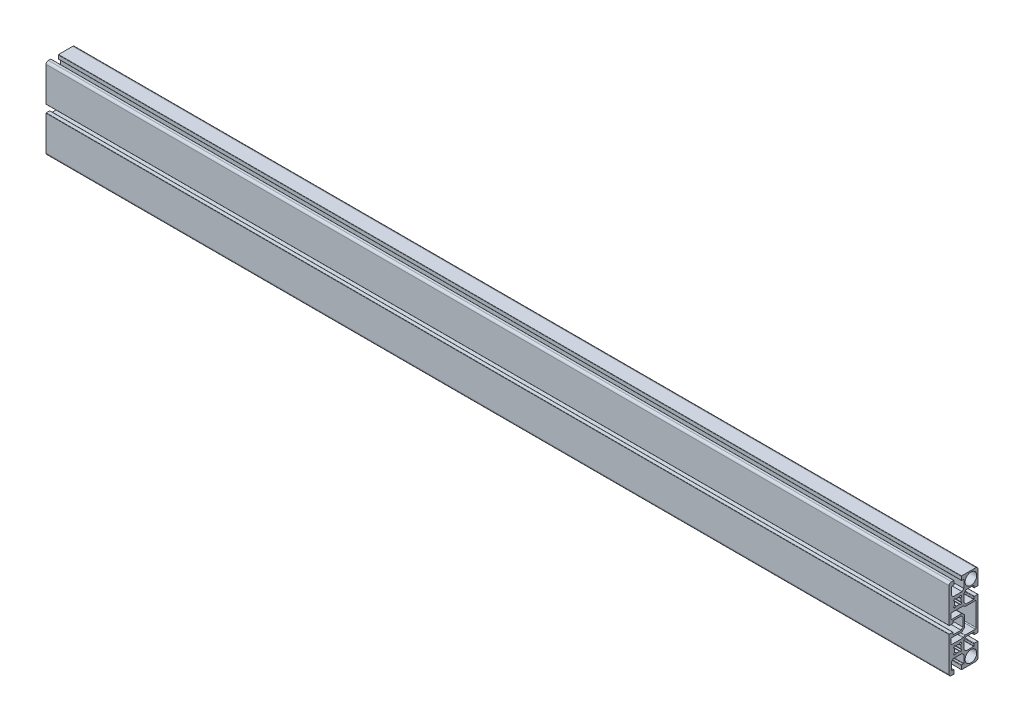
SolidWorks part; units mm, degrees
ref_plane "Front Plane" through (0, 0, 0) normal (0, 0, 1) x (1, 0, 0)
ref_plane "Top Plane" through (0, 0, 0) normal (0, 1, 0) x (1, 0, 0)
ref_plane "Right Plane" through (0, 0, 0) normal (1, 0, 0) x (0, 0, -1)
sketch "Sketch1" plane through (0, 0, 0) normal (0, 0, 1) x (1, 0, 0)
  line L0 (0, 0) -> (1000, 0)
  dimension "D1" = 1000
other "45-sarja 1.0033 90X32(1)"
ref_plane "Plane1" through (0, 0, 0) normal (1, 0, 0) x (0, 1, 0)
sketch "Model23" plane through (0, 0, 0) normal (1, 0, 0) x (0, 1, 0)
  line L0 (-12.7, -20.5) -> (12.7, -20.5)
  line L1 (13.7, -19.5) -> (13.7, -8.5072)
  line L2 (13.9929, -7.8) -> (15.0071, -6.7858)
  line L3 (15.3, -6.0787) -> (15.3, 6.5)
  line L4 (14.3, 7.5) -> (9.8, 7.5)
  line L5 (8.8, 6.5) -> (8.8, -4.4929)
  line L6 (8.5071, -5.2) -> (6.2, -7.5071)
  line L7 (5.4929, -7.8) -> (-5.4929, -7.8)
  line L8 (-6.2, -7.5071) -> (-8.5071, -5.2)
  line L9 (-8.8, -4.4929) -> (-8.8, 6.5)
  line L10 (-9.8, 7.5) -> (-14.3, 7.5)
  line L11 (-15.3, 6.5) -> (-15.3, -6.0787)
  line L12 (-15.0071, -6.7858) -> (-13.9929, -7.8)
  line L13 (-13.7, -8.5071) -> (-13.7, -19.5)
  line L14 (-25.8941, 4.3841) -> (-26.8841, 3.3941)
  line L15 (-26.8841, 2.9698) -> (-25.8633, 1.9491)
  line L16 (-25.8633, -1.9491) -> (-26.8841, -2.9698)
  line L17 (-26.8841, -3.3941) -> (-25.8941, -4.3841)
  line L18 (-25.4698, -4.3841) -> (-24.4491, -3.3633)
  line L19 (-20.5509, -3.3633) -> (-19.5302, -4.3841)
  line L20 (-19.1059, -4.3841) -> (-18.1159, -3.3941)
  line L21 (-18.1159, -2.9698) -> (-19.1367, -1.9491)
  line L22 (-19.1367, 1.9491) -> (-18.1159, 2.9698)
  line L23 (-18.1159, 3.3941) -> (-19.1059, 4.3841)
  line L24 (-19.5302, 4.3841) -> (-20.5509, 3.3633)
  line L25 (-24.4491, 3.3633) -> (-25.4698, 4.3841)
  line L26 (-41, -4.1) -> (-44.7, -4.1)
  line L27 (-40.5, -6.5) -> (-40.5, -4.6)
  line L28 (-31.7, -6.8) -> (-40.2, -6.8)
  line L29 (-29.7, -4.8) -> (-31.7, -6.8)
  line L30 (-29.7, 4.8) -> (-29.7, -4.8)
  line L31 (-31.7, 6.8) -> (-29.7, 4.8)
  line L32 (-40.2, 6.8) -> (-31.7, 6.8)
  line L33 (-40.5, 4.6) -> (-40.5, 6.5)
  line L34 (-44.7, 4.1) -> (-41, 4.1)
  line L35 (-45, 7) -> (-45, 4.4)
  line L36 (-4.4, 9.5) -> (-42.5, 9.5)
  line L37 (-4.1, 5.5) -> (-4.1, 9.2)
  line L38 (-6.5, 5) -> (-4.6, 5)
  line L39 (-6.8, -3.8) -> (-6.8, 4.7)
  line L40 (-4.8, -5.8) -> (-6.8, -3.8)
  line L41 (4.8, -5.8) -> (-4.8, -5.8)
  line L42 (6.8, -3.8) -> (4.8, -5.8)
  line L43 (6.8, 4.7) -> (6.8, -3.8)
  line L44 (4.6, 5) -> (6.5, 5)
  line L45 (4.1, 9.2) -> (4.1, 5.5)
  line L46 (42.5, 9.5) -> (4.4, 9.5)
  line L47 (45, 4.4) -> (45, 7)
  line L48 (41, 4.1) -> (44.7, 4.1)
  line L49 (40.5, 6.5) -> (40.5, 4.6)
  line L50 (31.7, 6.8) -> (40.2, 6.8)
  line L51 (29.7, 4.8) -> (31.7, 6.8)
  line L52 (29.7, -4.8) -> (29.7, 4.8)
  line L53 (31.7, -6.8) -> (29.7, -4.8)
  line L54 (40.2, -6.8) -> (31.7, -6.8)
  line L55 (40.5, -4.6) -> (40.5, -6.5)
  line L56 (44.7, -4.1) -> (41, -4.1)
  line L57 (45, -20) -> (45, -4.4)
  line L58 (26.9, -22.5) -> (42.5, -22.5)
  line L59 (26.6, -18.5) -> (26.6, -22.2)
  line L60 (29, -18) -> (27.1, -18)
  line L61 (29.3, -9.2) -> (29.3, -17.7)
  line L62 (27.3, -7.2) -> (29.3, -9.2)
  line L63 (17.7, -7.2) -> (27.3, -7.2)
  line L64 (15.7, -9.2) -> (17.7, -7.2)
  line L65 (15.7, -17.7) -> (15.7, -9.2)
  line L66 (17.9, -18) -> (16, -18)
  line L67 (18.4, -22.2) -> (18.4, -18.5)
  line L68 (-18.1, -22.5) -> (18.1, -22.5)
  line L69 (-18.4, -18.5) -> (-18.4, -22.2)
  line L70 (-16, -18) -> (-17.9, -18)
  line L71 (-15.7, -9.2) -> (-15.7, -17.7)
  line L72 (-17.7, -7.2) -> (-15.7, -9.2)
  line L73 (-27.3, -7.2) -> (-17.7, -7.2)
  line L74 (-29.3, -9.2) -> (-27.3, -7.2)
  line L75 (-29.3, -17.7) -> (-29.3, -9.2)
  line L76 (-27.1, -18) -> (-29, -18)
  line L77 (-26.6, -22.2) -> (-26.6, -18.5)
  line L78 (-42.5, -22.5) -> (-26.9, -22.5)
  line L79 (-45, -4.4) -> (-45, -20)
  line L80 (19.1059, 4.3841) -> (18.1159, 3.3941)
  line L81 (18.1159, 2.9698) -> (19.1367, 1.9491)
  line L82 (19.1367, -1.9491) -> (18.1159, -2.9698)
  line L83 (18.1159, -3.3941) -> (19.1059, -4.3841)
  line L84 (19.5302, -4.3841) -> (20.5509, -3.3633)
  line L85 (24.4491, -3.3633) -> (25.4698, -4.3841)
  line L86 (25.8941, -4.3841) -> (26.8841, -3.3941)
  line L87 (26.8841, -2.9698) -> (25.8633, -1.9491)
  line L88 (25.8633, 1.9491) -> (26.8841, 2.9698)
  line L89 (26.8841, 3.3941) -> (25.8941, 4.3841)
  line L90 (25.4698, 4.3841) -> (24.4491, 3.3633)
  line L91 (20.5509, 3.3633) -> (19.5302, 4.3841)
  arc A0 (-13.7, -19.5) -> (-12.7, -20.5) centre (-12.7, -19.5) ccw
  arc A1 (12.7, -20.5) -> (13.7, -19.5) centre (12.7, -19.5) ccw
  arc A2 (13.9929, -7.8) -> (13.7, -8.5072) centre (14.7, -8.5072) ccw
  arc A3 (15.0071, -6.7858) -> (15.3, -6.0787) centre (14.3, -6.0787) ccw
  arc A4 (15.3, 6.5) -> (14.3, 7.5) centre (14.3, 6.5) ccw
  arc A5 (9.8, 7.5) -> (8.8, 6.5) centre (9.8, 6.5) ccw
  arc A6 (8.5071, -5.2) -> (8.8, -4.4929) centre (7.8, -4.4929) ccw
  arc A7 (5.4929, -7.8) -> (6.2, -7.5071) centre (5.4929, -6.8) ccw
  arc A8 (-6.2, -7.5071) -> (-5.4929, -7.8) centre (-5.4929, -6.8) ccw
  arc A9 (-8.8, -4.4929) -> (-8.5071, -5.2) centre (-7.8, -4.4929) ccw
  arc A10 (-8.8, 6.5) -> (-9.8, 7.5) centre (-9.8, 6.5) ccw
  arc A11 (-14.3, 7.5) -> (-15.3, 6.5) centre (-14.3, 6.5) ccw
  arc A12 (-15.3, -6.0787) -> (-15.0071, -6.7858) centre (-14.3, -6.0787) ccw
  arc A13 (-13.7, -8.5071) -> (-13.9929, -7.8) centre (-14.7, -8.5071) ccw
  arc A14 (-25.4698, 4.3841) -> (-25.8941, 4.3841) centre (-25.682, 4.1719) ccw
  arc A15 (-26.8841, 3.3941) -> (-26.8841, 2.9698) centre (-26.6719, 3.182) ccw
  arc A16 (-25.8056, 1.6059) -> (-25.8633, 1.9491) centre (-26.0754, 1.7369) ccw
  arc A17 (-25.8056, 1.6059) -> (-25.8056, -1.6059) centre (-22.5, 0) ccw
  arc A18 (-25.8633, -1.9491) -> (-25.8056, -1.6059) centre (-26.0754, -1.7369) ccw
  arc A19 (-26.8841, -2.9698) -> (-26.8841, -3.3941) centre (-26.6719, -3.182) ccw
  arc A20 (-25.8941, -4.3841) -> (-25.4698, -4.3841) centre (-25.682, -4.1719) ccw
  arc A21 (-24.1059, -3.3056) -> (-24.4491, -3.3633) centre (-24.2369, -3.5754) ccw
  arc A22 (-24.1059, -3.3056) -> (-20.8941, -3.3056) centre (-22.5, 0) ccw
  arc A23 (-20.5509, -3.3633) -> (-20.8941, -3.3056) centre (-20.7631, -3.5754) ccw
  arc A24 (-19.5302, -4.3841) -> (-19.1059, -4.3841) centre (-19.318, -4.1719) ccw
  arc A25 (-18.1159, -3.3941) -> (-18.1159, -2.9698) centre (-18.3281, -3.182) ccw
  arc A26 (-19.1944, -1.6059) -> (-19.1367, -1.9491) centre (-18.9246, -1.7369) ccw
  arc A27 (-19.1944, -1.6059) -> (-19.1944, 1.6059) centre (-22.5, 0) ccw
  arc A28 (-19.1367, 1.9491) -> (-19.1944, 1.6059) centre (-18.9246, 1.7369) ccw
  arc A29 (-18.1159, 2.9698) -> (-18.1159, 3.3941) centre (-18.3281, 3.182) ccw
  arc A30 (-19.1059, 4.3841) -> (-19.5302, 4.3841) centre (-19.318, 4.1719) ccw
  arc A31 (-20.8941, 3.3056) -> (-20.5509, 3.3633) centre (-20.7631, 3.5754) ccw
  arc A32 (-20.8941, 3.3056) -> (-24.1059, 3.3056) centre (-22.5, 0) ccw
  arc A33 (-24.4491, 3.3633) -> (-24.1059, 3.3056) centre (-24.2369, 3.5754) ccw
  circle A34 centre (-37.15, -14.65) radius 6.45
  arc A35 (-40.5, -4.6) -> (-41, -4.1) centre (-41, -4.6) ccw
  arc A36 (-40.5, -6.5) -> (-40.2, -6.8) centre (-40.2, -6.5) ccw
  arc A37 (-40.2, 6.8) -> (-40.5, 6.5) centre (-40.2, 6.5) ccw
  arc A38 (-41, 4.1) -> (-40.5, 4.6) centre (-41, 4.6) ccw
  arc A39 (-45, 4.4) -> (-44.7, 4.1) centre (-44.7, 4.4) ccw
  arc A40 (-42.5, 9.5) -> (-45, 7) centre (-42.5, 7) ccw
  arc A41 (-4.1, 9.2) -> (-4.4, 9.5) centre (-4.4, 9.2) ccw
  arc A42 (-4.6, 5) -> (-4.1, 5.5) centre (-4.6, 5.5) ccw
  arc A43 (-6.5, 5) -> (-6.8, 4.7) centre (-6.5, 4.7) ccw
  arc A44 (6.8, 4.7) -> (6.5, 5) centre (6.5, 4.7) ccw
  arc A45 (4.1, 5.5) -> (4.6, 5) centre (4.6, 5.5) ccw
  arc A46 (4.4, 9.5) -> (4.1, 9.2) centre (4.4, 9.2) ccw
  arc A47 (45, 7) -> (42.5, 9.5) centre (42.5, 7) ccw
  arc A48 (44.7, 4.1) -> (45, 4.4) centre (44.7, 4.4) ccw
  arc A49 (40.5, 4.6) -> (41, 4.1) centre (41, 4.6) ccw
  arc A50 (40.5, 6.5) -> (40.2, 6.8) centre (40.2, 6.5) ccw
  arc A51 (40.2, -6.8) -> (40.5, -6.5) centre (40.2, -6.5) ccw
  arc A52 (41, -4.1) -> (40.5, -4.6) centre (41, -4.6) ccw
  arc A53 (45, -4.4) -> (44.7, -4.1) centre (44.7, -4.4) ccw
  arc A54 (42.5, -22.5) -> (45, -20) centre (42.5, -20) ccw
  arc A55 (26.6, -22.2) -> (26.9, -22.5) centre (26.9, -22.2) ccw
  arc A56 (27.1, -18) -> (26.6, -18.5) centre (27.1, -18.5) ccw
  arc A57 (29, -18) -> (29.3, -17.7) centre (29, -17.7) ccw
  arc A58 (15.7, -17.7) -> (16, -18) centre (16, -17.7) ccw
  arc A59 (18.4, -18.5) -> (17.9, -18) centre (17.9, -18.5) ccw
  arc A60 (18.1, -22.5) -> (18.4, -22.2) centre (18.1, -22.2) ccw
  arc A61 (-18.4, -22.2) -> (-18.1, -22.5) centre (-18.1, -22.2) ccw
  arc A62 (-17.9, -18) -> (-18.4, -18.5) centre (-17.9, -18.5) ccw
  arc A63 (-16, -18) -> (-15.7, -17.7) centre (-16, -17.7) ccw
  arc A64 (-29.3, -17.7) -> (-29, -18) centre (-29, -17.7) ccw
  arc A65 (-26.6, -18.5) -> (-27.1, -18) centre (-27.1, -18.5) ccw
  arc A66 (-26.9, -22.5) -> (-26.6, -22.2) centre (-26.9, -22.2) ccw
  arc A67 (-45, -20) -> (-42.5, -22.5) centre (-42.5, -20) ccw
  arc A68 (-44.7, -4.1) -> (-45, -4.4) centre (-44.7, -4.4) ccw
  circle A69 centre (37.15, -14.65) radius 6.45
  arc A70 (19.5302, 4.3841) -> (19.1059, 4.3841) centre (19.318, 4.1719) ccw
  arc A71 (18.1159, 3.3941) -> (18.1159, 2.9698) centre (18.3281, 3.182) ccw
  arc A72 (19.1944, 1.6059) -> (19.1367, 1.9491) centre (18.9246, 1.7369) ccw
  arc A73 (19.1944, 1.6059) -> (19.1944, -1.6059) centre (22.5, 0) ccw
  arc A74 (19.1367, -1.9491) -> (19.1944, -1.6059) centre (18.9246, -1.7369) ccw
  arc A75 (18.1159, -2.9698) -> (18.1159, -3.3941) centre (18.3281, -3.182) ccw
  arc A76 (19.1059, -4.3841) -> (19.5302, -4.3841) centre (19.318, -4.1719) ccw
  arc A77 (20.8941, -3.3056) -> (20.5509, -3.3633) centre (20.7631, -3.5754) ccw
  arc A78 (20.8941, -3.3056) -> (24.1059, -3.3056) centre (22.5, 0) ccw
  arc A79 (24.4491, -3.3633) -> (24.1059, -3.3056) centre (24.2369, -3.5754) ccw
  arc A80 (25.4698, -4.3841) -> (25.8941, -4.3841) centre (25.682, -4.1719) ccw
  arc A81 (26.8841, -3.3941) -> (26.8841, -2.9698) centre (26.6719, -3.182) ccw
  arc A82 (25.8056, -1.6059) -> (25.8633, -1.9491) centre (26.0754, -1.7369) ccw
  arc A83 (25.8056, -1.6059) -> (25.8056, 1.6059) centre (22.5, 0) ccw
  arc A84 (25.8633, 1.9491) -> (25.8056, 1.6059) centre (26.0754, 1.7369) ccw
  arc A85 (26.8841, 2.9698) -> (26.8841, 3.3941) centre (26.6719, 3.182) ccw
  arc A86 (25.8941, 4.3841) -> (25.4698, 4.3841) centre (25.682, 4.1719) ccw
  arc A87 (24.1059, 3.3056) -> (24.4491, 3.3633) centre (24.2369, 3.5754) ccw
  arc A88 (24.1059, 3.3056) -> (20.8941, 3.3056) centre (22.5, 0) ccw
  arc A89 (20.5509, 3.3633) -> (20.8941, 3.3056) centre (20.7631, 3.5754) ccw
  point P266 (-22.5, 0)
  point P267 (22.5003, 0)
  point P268 (0, -22.5)
  point P269 (0, 0)
  point P270 (-45, 9.5)
  point P271 (-45, -22.5)
  point P272 (45, -22.5)
  point P273 (45, 9.5)
  point P274 (0, 9.5)
  point P275 (0, 0)
